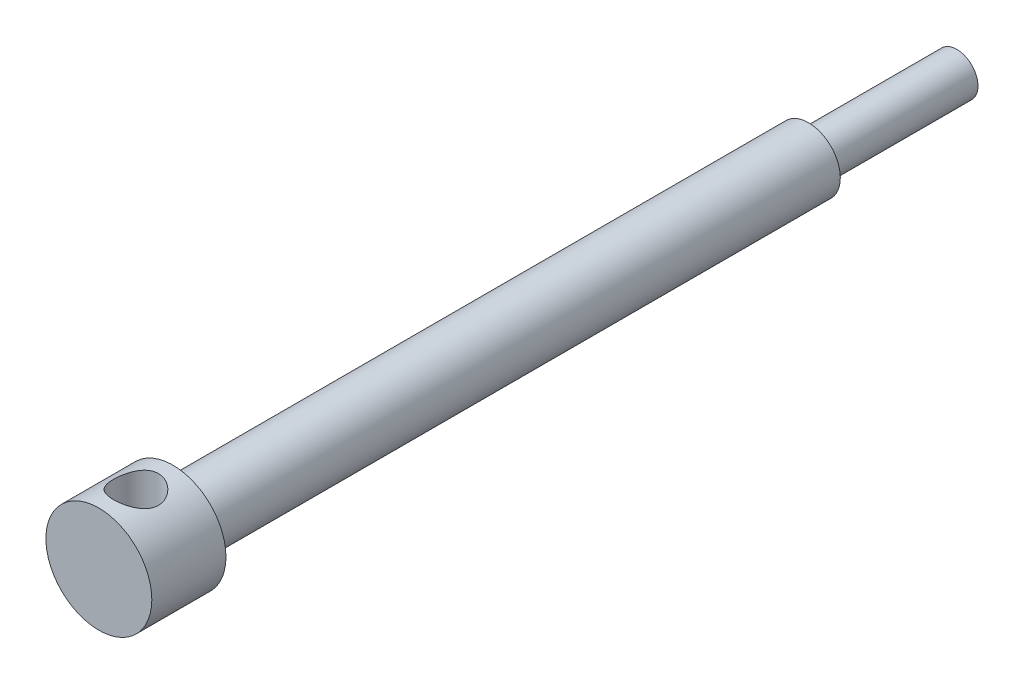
SolidWorks part; units mm, degrees
ref_plane "Front Plane" through (0, 0, 0) normal (0, 0, 1) x (1, 0, 0)
ref_plane "Top Plane" through (0, 0, 0) normal (0, 1, 0) x (1, 0, 0)
ref_plane "Right Plane" through (0, 0, 0) normal (1, 0, 0) x (0, 0, -1)
sketch "Sketch1" plane through (0, 0, 0) normal (1, 0, 0) x (0, 0, -1)
  line L0 (-83.2643, 0) -> (88.7628, 0) construction
  line L1 (-5.5562, 0) -> (-5.5562, 7.9375)
  line L2 (-5.5562, 7.9375) -> (5.5562, 7.9375)
  line L3 (5.5562, 7.9375) -> (5.5563, 4.7625)
  line L4 (5.5563, 4.7625) -> (100.8063, 4.7625)
  line L5 (100.8063, 4.7625) -> (100.8063, 3.175)
  line L6 (100.8063, 3.175) -> (123.0312, 3.175)
  line L7 (123.0312, 3.175) -> (123.0312, 0)
  line L8 (123.0312, 0) -> (-5.5562, 0)
  line L9 (0, 7.9375) -> (0, -7.9375) construction
  dimension "D1" = 11.1125
  dimension "D2" = 106.3625
  dimension "D3" = 128.5875
  dimension "D4" = 15.875
  dimension "D5" = 9.525
  dimension "D6" = 6.35
revolve "Revolve1" add sketch "Sketch1" angle 360 about L0
hole_wizard "#97 (0.0059) Diameter Hole1" positions "3DSketch1" profile "Sketch2" hole size "#97" standard "Ansi Inch"
sketch3d "3DSketch1"
  point P0 (0, 0, 0)
  point P4 (0, -7.9375, 0)
sketch "Sketch2" plane through (0, -7.9375, 0) normal (1, 0, 0) x (0, 0, -1)
  line L0 (0, 0) -> (0, 15.875)
  line L1 (0, 15.875) -> (3.3782, 15.875)
  line L2 (3.3782, 15.875) -> (3.3782, 0)
  line L5 (3.3782, 0) -> (0, 0)
  line L11 (0, -6.35) -> (0, 107.95) construction
  dimension "Thru Hole Dia." = 6.7564
  dimension "Thru Hole Depth" = 15.875
